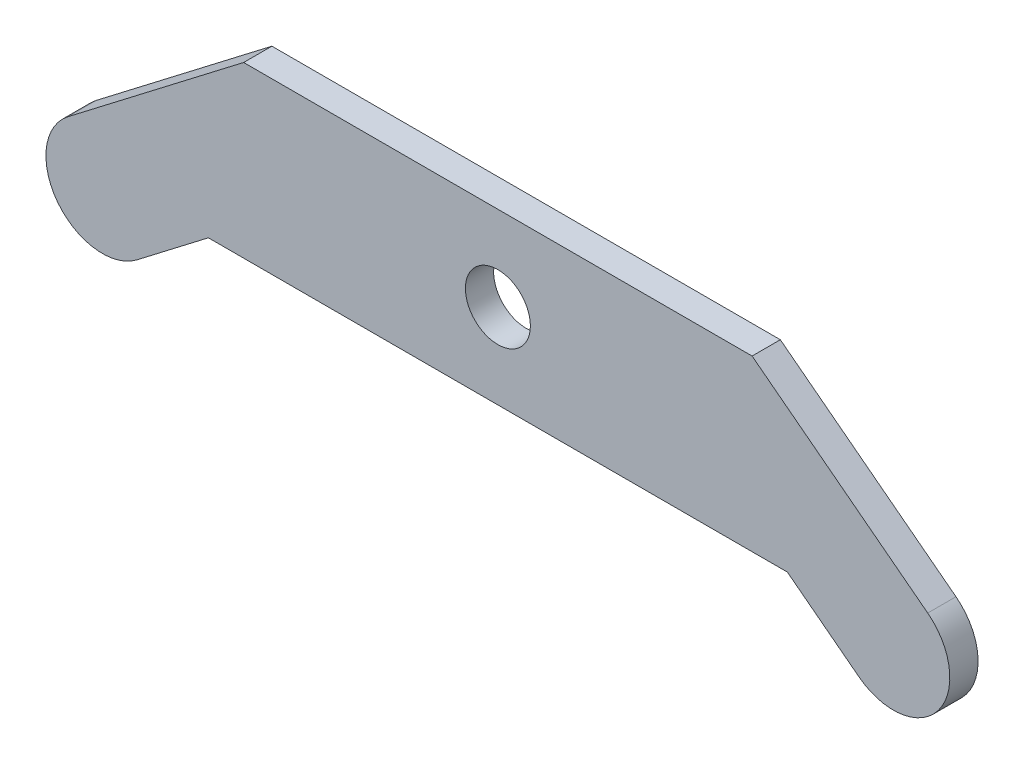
SolidWorks part; units mm, degrees
ref_plane "Front" through (0, 0, 0) normal (0, 0, 1) x (1, 0, 0)
ref_plane "Top" through (0, 0, 0) normal (0, 1, 0) x (1, 0, 0)
ref_plane "Right" through (0, 0, 0) normal (1, 0, 0) x (0, 0, -1)
sketch "Sketch1" plane through (0, 0, 0) normal (0, 0, 1) x (1, 0, 0)
  line L0 (-45, 0) -> (45, 0)
  line L1 (45, 0) -> (76.0876, -23.8544)
  line L2 (63.9124, -39.7214) -> (51.2432, -30)
  line L3 (51.2432, -30) -> (-51.2432, -30)
  line L4 (-51.2432, -30) -> (-63.9124, -39.7214)
  line L5 (-76.0876, -23.8544) -> (-45, 0)
  line L6 (0, 0) -> (0, -30) construction
  line L7 (-70, -31.7879) -> (-48.1216, -15) construction
  line L8 (-48.1216, -15) -> (0, -15) construction
  line L9 (0, -15) -> (48.1216, -15) construction
  line L10 (48.1216, -15) -> (70, -31.7879) construction
  arc A0 (76.0876, -23.8544) -> (63.9124, -39.7214) centre (70, -31.7879) cw
  arc A1 (-63.9124, -39.7214) -> (-76.0876, -23.8544) centre (-70, -31.7879) cw
  circle A2 centre (0, -15) radius 5.75
  dimension "D2" = 10
  dimension "D6" = 11.5
  dimension "D1" = 30
  dimension "D3" = 90
  dimension "D4" = 105
  dimension "D5" = 140
extrude "Boss-Extrude1" add sketch "Sketch1" along normal mid plane 5
sketch "Sketch2" plane through (0, 0, 0) normal (0, 0, 1) x (1, 0, 0)
  circle A0 centre (70, -31.7879) radius 5
  dimension "D1" = 10
extrude "Boss-Extrude2" [suppressed] add sketch "Sketch2" along normal mid plane 15
sketch "Sketch4" [suppressed] plane through (0, 0, 0) normal (0, 0, 1) x (1, 0, 0)
  circle A0 centre (70, -31.7879) radius 3.25
  circle A1 centre (70, -31.7879) radius 5 construction
  dimension "D1" = 6.5
extrude "Cut-Extrude1" [suppressed] cut sketch "Sketch4" against normal through all both and the other way through all
mirror "Mirror1" [suppressed] about plane through (0, 0, 0) normal (1, 0, 0)
